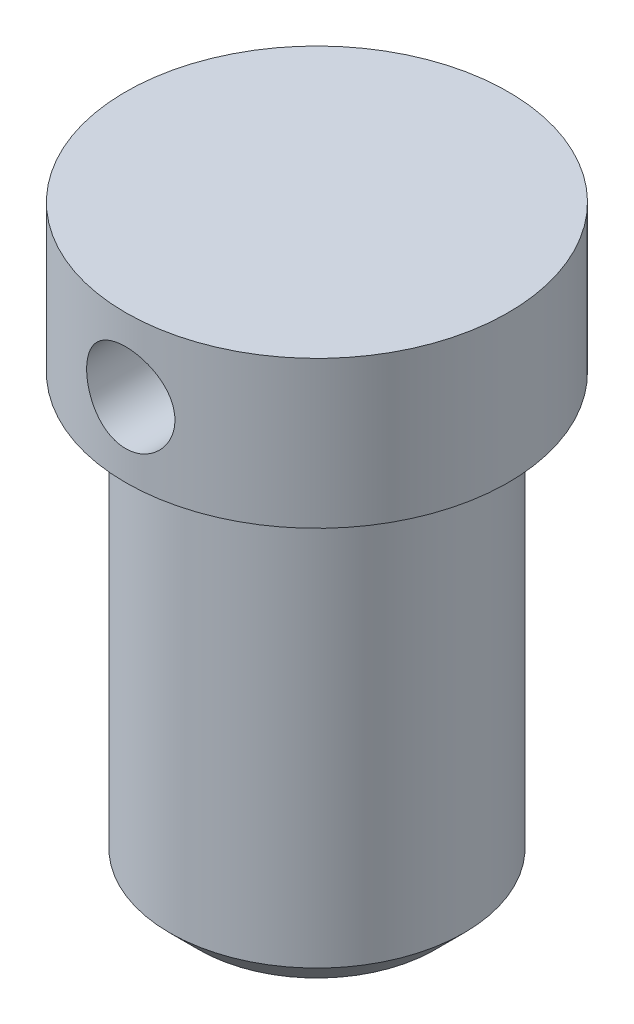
SolidWorks part; units mm, degrees
ref_plane "Plan de face" through (0, 0, 0) normal (0, 0, 1) x (1, 0, 0)
ref_plane "Plan de dessus" through (0, 0, 0) normal (0, 1, 0) x (1, 0, 0)
ref_plane "Plan de droite" through (0, 0, 0) normal (1, 0, 0) x (0, 0, -1)
sketch "Esquisse1" plane through (0, 0, 0) normal (0, 1, 0) x (1, 0, 0)
  circle A0 centre (0, 0) radius 5
  dimension "D1" = 10
extrude "Boss.-Extru.1" add sketch "Esquisse1" along normal blind 15
sketch "Esquisse2" plane through (0, 15, 0) normal (0, 1, 0) x (1, 0, 0)
  circle A0 centre (0, 0) radius 6.5
  dimension "D1" = 13
extrude "Boss.-Extru.2" add sketch "Esquisse2" along normal blind 5
sketch "Esquisse3" plane through (0, 0, 0) normal (0, 0, 1) x (1, 0, 0)
  line L0 (-5, 15) -> (-5, 0) construction
  line L1 (-5, 15) -> (5, 15) construction
  circle A0 centre (0, 17.5) radius 1.5
  dimension "D1" = 3
  dimension "D3" = 2.5
  dimension "D2" = 5
extrude "Enlèv. mat.-Extru.1" cut sketch "Esquisse3" against normal blind 9 and the other way blind 10
chamfer "Chanfrein1" distance 1 angle 45 1 edges at (0, 0, 5)
